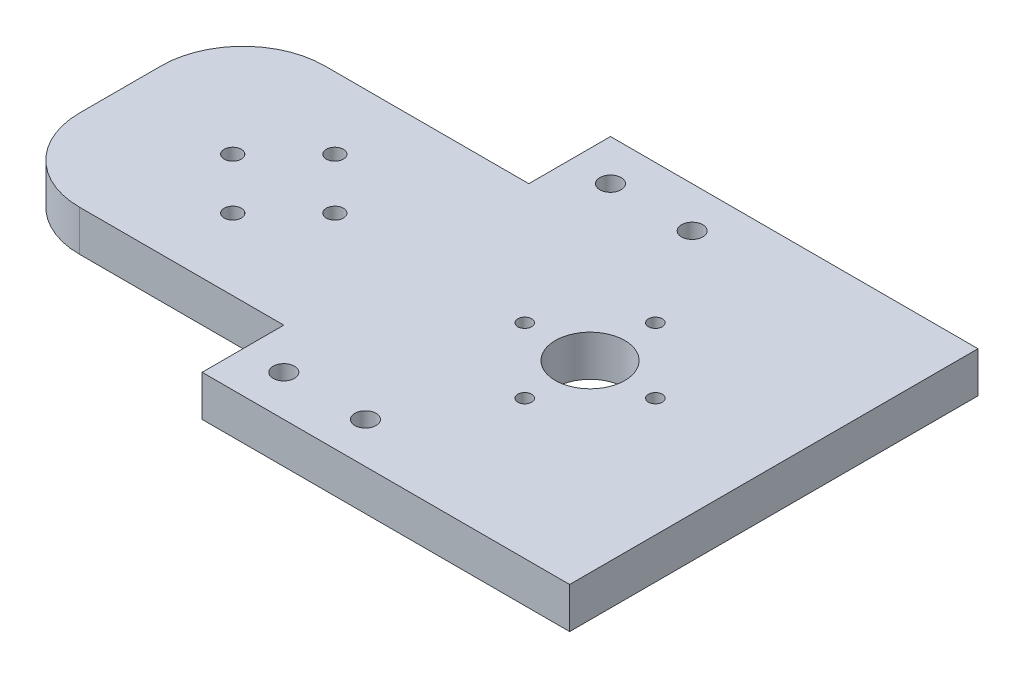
SolidWorks part; units mm, degrees
ref_plane "前视基准面" through (0, 0, 0) normal (0, 0, 1) x (1, 0, 0)
ref_plane "上视基准面" through (0, 0, 0) normal (0, 1, 0) x (1, 0, 0)
ref_plane "右视基准面" through (0, 0, 0) normal (1, 0, 0) x (0, 0, -1)
other "Configuration Table"
sketch "草图2" plane through (0, 0, 0) normal (0, 1, 0) x (1, 0, 0)
  line L0 (0, 50) -> (0, -50)
  line L1 (0, -50) -> (-90, -50)
  line L2 (-90, -50) -> (-90, -30)
  line L3 (-90, -30) -> (-160, -30)
  line L4 (-160, -30) -> (-160, 30)
  line L5 (-160, 30) -> (-90, 30)
  line L6 (-90, 30) -> (-90, 50)
  line L7 (-90, 50) -> (0, 50)
  dimension "D1" = 100
  dimension "D2" = 90
  dimension "D3" = 90
  dimension "D4" = 160
  dimension "D5" = 20
  dimension "D6" = 20
extrude "凸台-拉伸2" add sketch "草图2" along normal blind 10
fillet "圆角2" radius 20 2 edges at (-160, 5, 30) (-160, 5, -30)
sketch "草图4" plane through (0, 10, 0) normal (0, 1, 0) x (1, 0, 0)
  circle A0 centre (-60, -40) radius 2.6
  circle A1 centre (-80, -40) radius 2.6
  circle A2 centre (-80, 40) radius 2.6
  circle A3 centre (-60, 40) radius 2.6
  dimension "D1" = 5.2
  dimension "D2" = 5.2
  dimension "D3" = 5.2
  dimension "D4" = 5.2
extrude "切除-拉伸2" cut sketch "草图4" against normal through all
sketch "草图5" plane through (0, 0, 0) normal (0, -1, 0) x (1, 0, 0)
  circle A0 centre (-45, 0) radius 8.5
  dimension "D1" = 17
extrude "切除-拉伸3" cut sketch "草图5" against normal through all
sketch "草图17" plane through (0, 0, 0) normal (0, -1, 0) x (1, 0, 0)
  line L0 (-45, 0) -> (-45, -50) construction
  line L1 (0, -50) -> (-90, -50) construction
  line L2 (-45, 0) -> (-45, 50) construction
  line L3 (-90, 50) -> (0, 50) construction
  line L4 (0, 0) -> (-160, 0) construction
  line L5 (-160, -10) -> (-160, 10) construction
  circle A0 centre (-45, 16) radius 1.7
  circle A1 centre (-45, -16) radius 1.7
  circle A2 centre (-45, 0) radius 8.5 construction
  circle A3 centre (-29, 0) radius 1.7
  circle A4 centre (-61, 0) radius 1.7
  dimension "D1" = 3.4
  dimension "D2" = 3.4
  dimension "D3" = 16
  dimension "D4" = 16
  dimension "D5" = 3.4
  dimension "D6" = 16
extrude "切除-拉伸11" cut sketch "草图17" against normal blind 10
sketch "草图18" plane through (0, 0, 0) normal (0, -1, 0) x (1, 0, 0)
  line L0 (-160, -10) -> (-160, 10) construction
  circle A0 centre (-120, 0) radius 12.5 construction
  circle A1 centre (-120, 12.5) radius 2.1
  circle A2 centre (-132.5, 0) radius 2.1
  circle A3 centre (-120, -12.5) radius 2.1
  circle A4 centre (-107.5, 0) radius 2.1
  dimension "D1" = 25
  dimension "D2" = 40
  dimension "D3" = 4.2
  dimension "D4" = 4.2
  dimension "D5" = 4.2
  dimension "D6" = 4.2
extrude "切除-拉伸12" cut sketch "草图18" against normal blind 10
